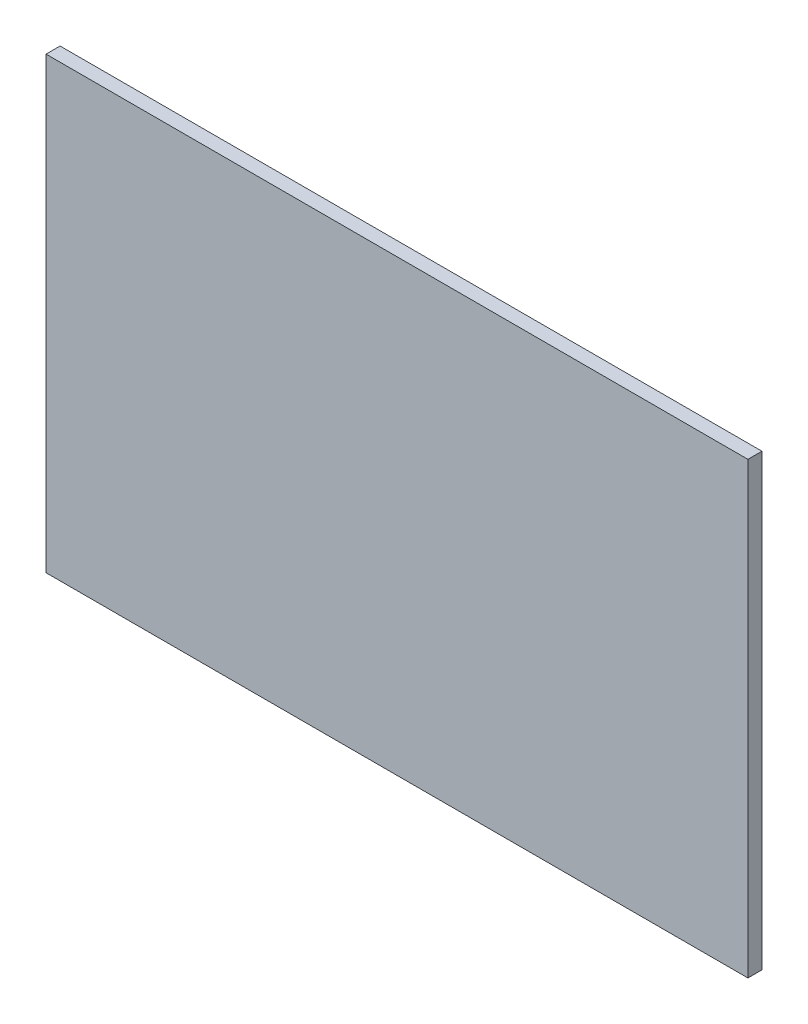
SolidWorks part; units mm, degrees
ref_plane "Front Plane" through (0, 0, 0) normal (0, 0, 1) x (1, 0, 0)
ref_plane "Top Plane" through (0, 0, 0) normal (0, 1, 0) x (1, 0, 0)
ref_plane "Right Plane" through (0, 0, 0) normal (1, 0, 0) x (0, 0, -1)
sketch "Sketch2" plane through (0, 0, 0) normal (0, 0, 1) x (1, 0, 0)
  line L1 (0, 0) -> (317.5, 0)
  line L2 (0, 0) -> (0, 203.2)
  line L3 (0, 203.2) -> (317.5, 203.2)
  line L4 (317.5, 0) -> (317.5, 203.2)
  dimension "D1" = 317.5
  dimension "D2" = 203.2
extrude "Boss-Extrude1" add sketch "Sketch2" along normal blind 6.35
